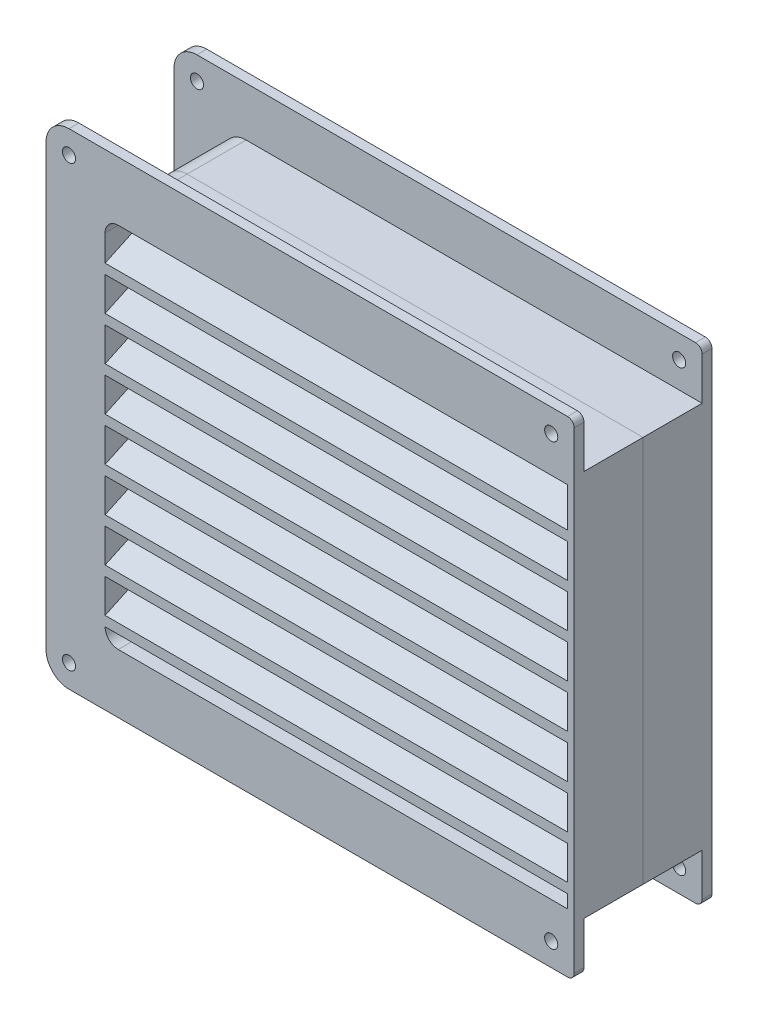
SolidWorks part; units mm, degrees
ref_plane "Спереди" through (0, 0, 0) normal (0, 0, 1) x (1, 0, 0)
ref_plane "Сверху" through (0, 0, 0) normal (0, 1, 0) x (1, 0, 0)
ref_plane "Справа" through (0, 0, 0) normal (1, 0, 0) x (0, 0, -1)
sketch "Эскиз1" plane through (0, 0, 0) normal (1, 0, 0) x (0, 0, -1)
  line L0 (0, 0) -> (0, 118) construction
  line L1 (0, 0) -> (-21, 0)
  line L2 (0, 0) -> (0, 3)
  line L3 (0, 3) -> (-21, 3)
  line L4 (-21, 0) -> (-21, 3)
  line L5 (0, 115) -> (-21, 115)
  line L6 (0, 115) -> (0, 118)
  line L7 (0, 118) -> (-21, 118)
  line L8 (-21, 115) -> (-21, 118)
  line L9 (0, 7) -> (-15, 13.9946)
  line L10 (-15, 13.9946) -> (-15, 16.9946)
  line L11 (-15, 16.9946) -> (0, 10)
  line L12 (0, 10) -> (0, 7)
  line L13 (-15, 27.2803) -> (-15, 30.2803)
  line L14 (-15, 30.2803) -> (0, 23.2857)
  line L15 (0, 23.2857) -> (0, 20.2857)
  line L16 (0, 20.2857) -> (-15, 27.2803)
  line L17 (-15, 40.566) -> (-15, 43.566)
  line L18 (-15, 43.566) -> (0, 36.5714)
  line L19 (0, 36.5714) -> (0, 33.5714)
  line L20 (0, 33.5714) -> (-15, 40.566)
  line L21 (-15, 53.8518) -> (-15, 56.8518)
  line L22 (-15, 56.8518) -> (0, 49.8571)
  line L23 (0, 49.8571) -> (0, 46.8571)
  line L24 (0, 46.8571) -> (-15, 53.8518)
  line L25 (-15, 67.1375) -> (-15, 70.1375)
  line L26 (-15, 70.1375) -> (0, 63.1429)
  line L27 (0, 63.1429) -> (0, 60.1429)
  line L28 (0, 60.1429) -> (-15, 67.1375)
  line L29 (-15, 80.4232) -> (-15, 83.4232)
  line L30 (-15, 83.4232) -> (0, 76.4286)
  line L31 (0, 76.4286) -> (0, 73.4286)
  line L32 (0, 73.4286) -> (-15, 80.4232)
  line L49 (-15, 93.7089) -> (-15, 96.7089)
  line L50 (-15, 96.7089) -> (0, 89.7143)
  line L51 (0, 89.7143) -> (0, 86.7143)
  line L52 (0, 86.7143) -> (-15, 93.7089)
  line L53 (-15, 106.9946) -> (-15, 109.9946)
  line L54 (-15, 109.9946) -> (0, 103)
  line L55 (0, 103) -> (0, 100)
  line L56 (0, 100) -> (-15, 106.9946)
  dimension "D2" = 118
  dimension "D3" = 3
  dimension "D4" = 21
  dimension "D5" = 4
  dimension "D6" = 12
  dimension "D7" = 15
  dimension "D8" = 65
  dimension "D9" = 3.2911
  dimension "D1" = 8
extrude "Бобышка-Вытянуть1" add sketch "Эскиз1" along normal blind 146
sketch "Эскиз2" plane through (0, 0, 0) normal (0, 0, -1) x (-1, 0, 0)
  line L0 (-146, 0) -> (0, 0) construction
  line L1 (-146, 118) -> (-144, 118)
  line L2 (-146, 118) -> (-146, 0)
  line L3 (-146, 0) -> (-144, 0)
  line L4 (-144, 118) -> (-144, 0)
  line L6 (0, 118) -> (-3, 118)
  line L7 (0, 118) -> (0, 0)
  line L8 (0, 0) -> (-3, 0)
  line L9 (-3, 118) -> (-3, 0)
  dimension "D1" = 2
  dimension "D2" = 3
extrude "Бобышка-Вытянуть2" add sketch "Эскиз2" against normal up to surface (21 mm away)
sketch "Эскиз3" plane through (0, 0, 0) normal (0, 0, -1) x (-1, 0, 0)
  line L0 (0, 59) -> (-146, 59) construction
  line L1 (-146, 0) -> (15, 0)
  line L2 (-146, 0) -> (-146, -15)
  line L3 (-146, -15) -> (15, -15)
  line L4 (15, 0) -> (15, -15)
  line L5 (0, 0) -> (0, 118) construction
  line L6 (-146, 0) -> (-146, 118) construction
  line L7 (-65.5, -15) -> (-65.5, 0) construction
  line L12 (15, 118) -> (15, 133)
  line L13 (-146, 133) -> (15, 133)
  line L14 (-146, 118) -> (-146, 133)
  line L15 (-146, 118) -> (15, 118)
  circle A2 centre (-139, -8) radius 2
  circle A3 centre (8, -8) radius 2
  circle A8 centre (8, 126) radius 2
  circle A9 centre (-139, 126) radius 2
extrude "Бобышка-Вытянуть3" add sketch "Эскиз3" against normal blind 3
sketch "Эскиз5" plane through (0, 0, 0) normal (0, 0, -1) x (-1, 0, 0)
  line L1 (15, 118) -> (0, 118)
  line L2 (15, 118) -> (15, 0)
  line L3 (15, 0) -> (0, 0)
  line L4 (0, 118) -> (0, 0)
extrude "Бобышка-Вытянуть4" add sketch "Эскиз5" against normal up to surface (3 mm away)
fillet "Скругление2" radius 7 2 edges at (0, 0, 12) (0, 118, 12)
fillet "Скругление3" radius 4 2 edges at (3, 3, 10.5) (3, 115, 10.5)
fillet "Скругление4" radius 2 2 edges at (146, -15, 1.5) (146, 133, 1.5)
fillet "Скругление5" radius 7 2 edges at (-15, -15, 1.5) (-15, 133, 1.5)
mirror "Зеркальное отражение1" about plane through (146, 0, 21) normal (0, 0, -1)
equation "\"D4@Эскиз3\"=\"D3@Эскиз3\""
equation "\"D6@Эскиз3\"=\"D1@Эскиз3\""
